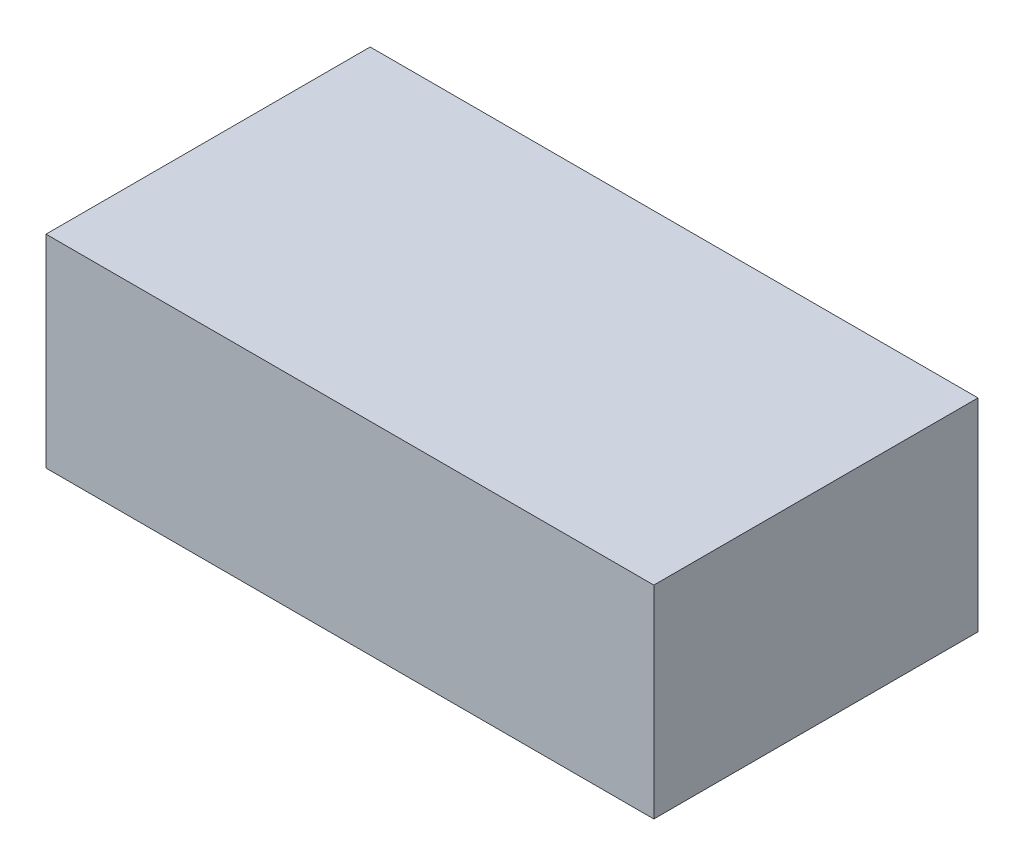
SolidWorks part; units mm, degrees
ref_plane "Front Plane" through (0, 0, 0) normal (0, 0, 1) x (1, 0, 0)
ref_plane "Top Plane" through (0, 0, 0) normal (0, 1, 0) x (1, 0, 0)
ref_plane "Right Plane" through (0, 0, 0) normal (1, 0, 0) x (0, 0, -1)
sketch "Sketch1" plane through (0, 7.9849, 0) normal (0, 1, 0) x (1, 0, 0)
  line L1 (-88.3452, 40) -> (61.6548, 40)
  line L2 (-88.3452, 40) -> (-88.3452, -40)
  line L3 (-88.3452, -40) -> (61.6548, -40)
  line L4 (61.6548, 40) -> (61.6548, -40)
  line L5 (-88.3452, 40) -> (61.6548, -40) construction
  line L6 (-88.3452, -40) -> (61.6548, 40) construction
  point P0 (-13.3452, 0)
  dimension "D1" = 150
  dimension "D2" = 80
extrude "Boss-Extrude1" add sketch "Sketch1" along normal blind 50 contours L3 L4 L1 L2
other "Cavity1"
other "Base2<1>@Assem21"
